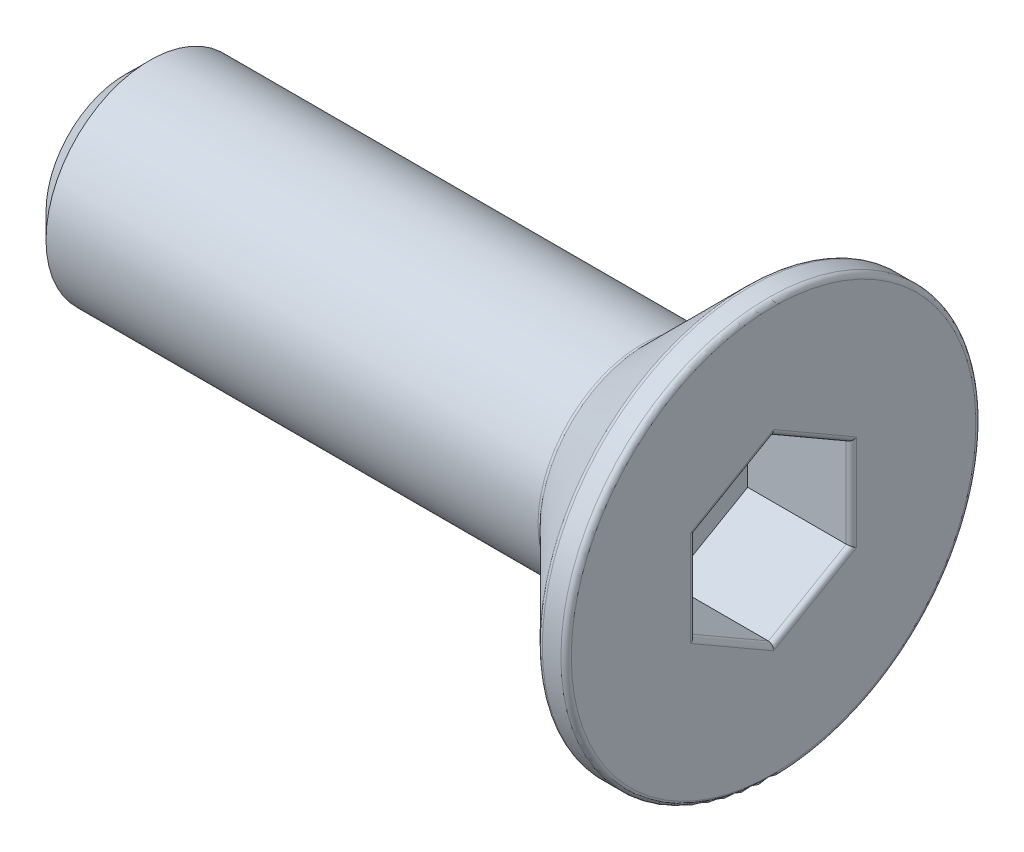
SolidWorks part; units mm, degrees
ref_plane "Plan1" through (0, 0, 0) normal (0, 0, 1) x (1, 0, 0)
ref_plane "Plan2" through (0, 0, 0) normal (0, 1, 0) x (1, 0, 0)
ref_plane "Plan3" through (0, 0, 0) normal (1, 0, 0) x (0, 0, -1)
sketch "Esquisse1" plane through (0, 0, 0) normal (0, 0, 1) x (1, 0, 0)
  line L0 (0, 0) -> (67.5598, 0) construction
  line L1 (0, 0) -> (0, 2)
  line L2 (0, 2) -> (14, 2)
  line L3 (14, 2) -> (16, 4)
  line L4 (16, 4) -> (16.5, 4)
  line L5 (16.5, 4) -> (16.5, 0)
  line L6 (0, 0) -> (16.5, 0)
  dimension "D1" = 2
  dimension "D2" = 14
  dimension "D3" = 45
  dimension "D4" = 4
  dimension "D5" = 0.5
revolve "Révolution1" add sketch "Esquisse1" angle 360 about L0
sketch "Esquisse2" plane through (16.5, 0, 0) normal (1, 0, 0) x (0, 0, -1)
  line L1 (0, -1.7321) -> (1.5, -0.866)
  line L2 (1.5, -0.866) -> (1.5, 0.866)
  line L3 (1.5, 0.866) -> (0, 1.7321)
  line L4 (0, 1.7321) -> (-1.5, 0.866)
  line L5 (-1.5, 0.866) -> (-1.5, -0.866)
  line L6 (-1.5, -0.866) -> (0, -1.7321)
  circle A0 centre (0, 0) radius 1.5 construction
  dimension "D1" = 3
extrude "Enlèv. mat.-Extru.1" cut sketch "Esquisse2" against normal blind 2
sketch "Esquisse5" plane through (0, 0, 0) normal (0, 0, 1) x (1, 0, 0)
  line L0 (0, 0) -> (3.723, 0) construction
  line L2 (4.7478, 2.2742) -> (-0.6932, 2.2742)
  line L3 (-0.6932, 2.2742) -> (-0.6932, 0)
  line L7 (4, 1.5264) -> (4, 0)
  line L8 (4, 0) -> (-0.6932, 0)
  line L9 (4, 1.5264) -> (4.7478, 2.2742)
revolve "Enlèvement de matière-Révolution1" cut sketch "Esquisse5" angle 360 about L0
fillet "Congé1" radius 0.1
